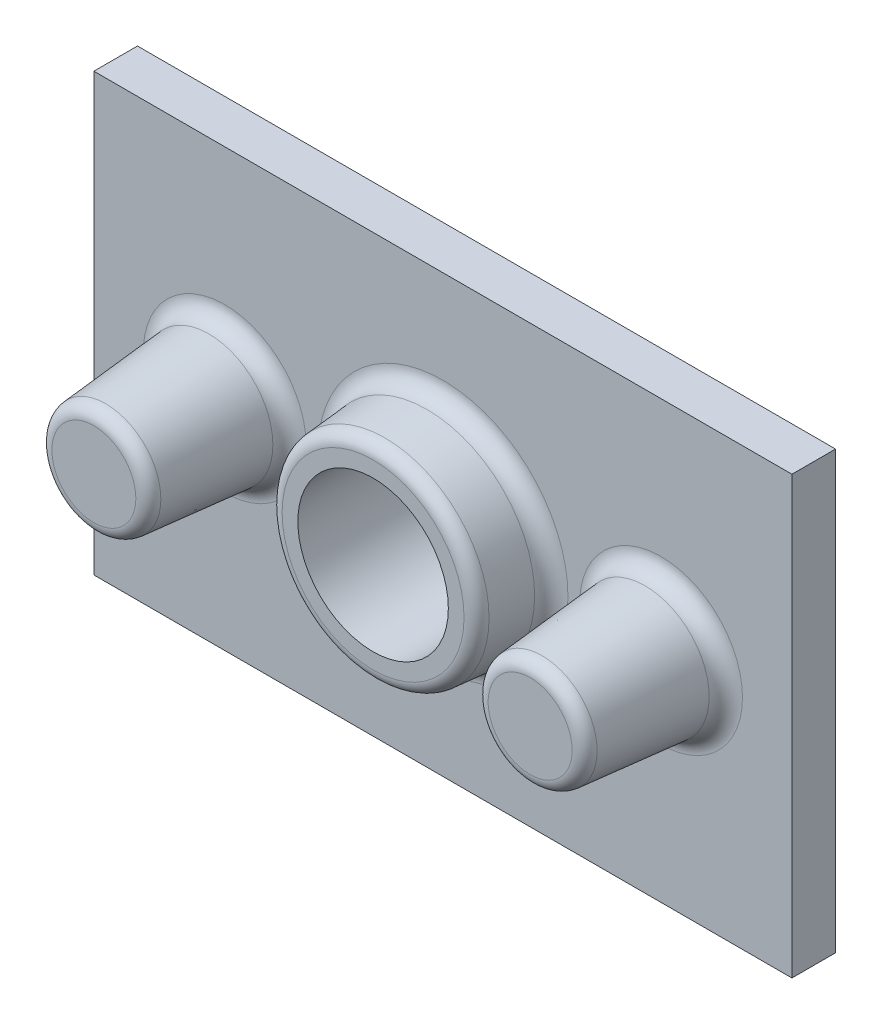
SolidWorks part; units mm, degrees
ref_plane "Plan de face" through (0, 0, 0) normal (0, 0, 1) x (1, 0, 0)
ref_plane "Plan de dessus" through (0, 0, 0) normal (0, 1, 0) x (1, 0, 0)
ref_plane "Plan de droite" through (0, 0, 0) normal (1, 0, 0) x (0, 0, -1)
sketch "Esquisse1" plane through (0, 0, 0) normal (0, 0, 1) x (1, 0, 0)
  line L0 (-40, 25) -> (40, -25) construction
  line L1 (-40, 25) -> (40, 25)
  line L2 (-40, 25) -> (-40, -25)
  line L3 (-40, -25) -> (40, -25)
  line L4 (40, 25) -> (40, -25)
  dimension "D1" = 80
  dimension "D2" = 50
extrude "Extrusion1" add sketch "Esquisse1" along normal blind 5
sketch "Esquisse2" plane through (0, 0, 5) normal (0, 0, 1) x (1, 0, 0)
  circle A0 centre (0, 0) radius 12.5
  dimension "D1" = 25
extrude "Extrusion2" add sketch "Esquisse2" along normal blind 8 draft 5
sketch "Esquisse4" plane through (0, 0, 0) normal (0, 0, -1) x (-1, 0, 0)
  circle A0 centre (-25, 0) radius 7.25
  circle A1 centre (25, 0) radius 7.25
  dimension "D1" = 14.5
  dimension "D2" = 14.5
  dimension "D3" = 25
  dimension "D4" = 25
extrude "Extrusion3" add sketch "Esquisse4" along normal blind 7.2 draft 5
sketch "Esquisse5" plane through (0, 0, 5) normal (0, 0, 1) x (1, 0, 0)
  circle A0 centre (-25, 0) radius 7.5
  circle A1 centre (25, 0) radius 7.5
  dimension "D1" = 15
  dimension "D2" = 15
  dimension "D3" = 25
  dimension "D4" = 25
extrude "Extrusion4" add sketch "Esquisse5" along normal blind 15 draft 5
fillet "Congé1" radius 2 3 edges at (32.5, 0, 5) (12.5, 0, 5) (-17.5, 0, 5)
fillet "Congé2" radius 1.5 3 edges at (31.1877, 0, 20) (11.8001, 0, 13) (-18.8123, 0, 20)
hole_wizard "Trou taraudé M81" positions "Esquisse7" profile "Esquisse6" tap size "M8" standard "ISO"
sketch "Esquisse7" plane through (0, 0, -7.2) normal (0, 0, -1) x (-1, 0, 0)
  circle A0 centre (25, 0) radius 6.6201 construction
  circle A1 centre (-25, 0) radius 6.6201 construction
  point P0 (25, 0)
  point P1 (-25, 0)
sketch "Esquisse6" plane through (-25, 0, -7.2) normal (1, 0, 0) x (0, 1, 0)
  line L0 (0, 0) -> (0, 25.0429)
  line L1 (0, 25.0429) -> (3.4, 23)
  line L2 (3.4, 23) -> (3.4, 0)
  line L5 (3.4, 0) -> (0, 0)
  line L10 (0, 25.0429) -> (-3.4, 23) construction
  line L11 (0, -6.35) -> (0, 107.95) construction
  dimension "Diamètre du trou pour taraudage" = 6.8
  dimension "Profondeur du trou pour taraudage" = 23
  dimension "Angle de pointe" = 118
fillet "Congé3" radius 2 2 edges at (-17.75, 0, 0) (32.25, 0, 0)
sketch "Esquisse8" plane through (0, 0, 0) normal (0, 0, -1) x (-1, 0, 0)
  circle A0 centre (0, 0) radius 12.5
  dimension "D1" = 25
extrude "Extrusion5" add sketch "Esquisse8" along normal blind 2
fillet "Congé4" radius 2 1 edges at (12.5, 0, 0)
sketch "Esquisse3" plane through (0, 0, 13) normal (0, 0, 1) x (1, 0, 0)
  circle A0 centre (0, 0) radius 8.625
  dimension "D1" = 17.25
extrude "Enlèv. mat.-Extru.1" cut sketch "Esquisse3" against normal through all
chamfer "Chanfrein1" distance 0.7 angle 45 1 edges at (-8.625, 0, -2)
